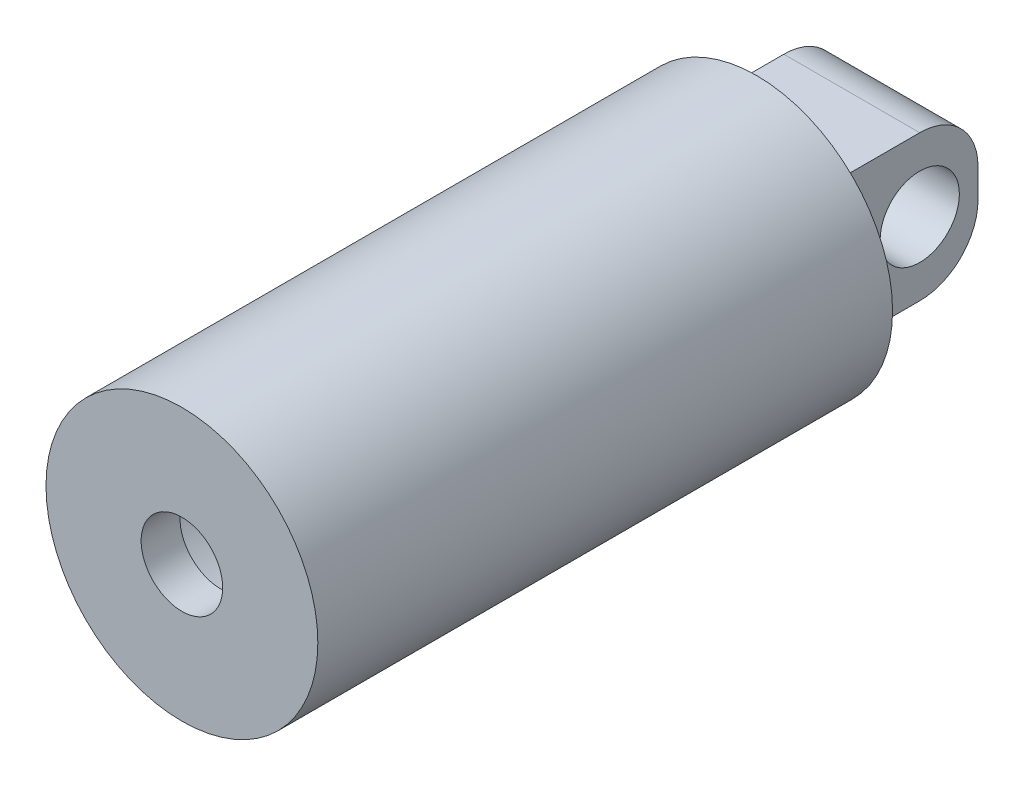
SolidWorks part; units mm, degrees
ref_plane "Front Plane" through (0, 0, 0) normal (0, 0, 1) x (1, 0, 0)
ref_plane "Top Plane" through (0, 0, 0) normal (0, 1, 0) x (1, 0, 0)
ref_plane "Right Plane" through (0, 0, 0) normal (1, 0, 0) x (0, 0, -1)
sketch "Sketch1" plane through (0, 0, 0) normal (0, 0, 1) x (1, 0, 0)
  circle A0 centre (0, 0) radius 38.1
  circle A1 centre (0, 0) radius 44.45
  dimension "D1" = 76.2
  dimension "D2" = 6.35
extrude "Boss-Extrude1" add sketch "Sketch1" against normal blind 190.5
sketch "Sketch2" plane through (0, 0, 0) normal (0, 0, 1) x (1, 0, 0)
  circle A0 centre (0, 0) radius 13.335
  circle A1 centre (0, 0) radius 44.45
  circle A2 centre (0, 0) radius 44.45
  dimension "D2" = 26.67
  dimension "D1" = 0
extrude "Boss-Extrude2" add sketch "Sketch2" against normal blind 12.7
sketch "Sketch3" plane through (0, 0, -190.5) normal (0, 0, -1) x (-1, 0, 0)
  circle A1 centre (0, 0) radius 44.45
  circle A2 centre (0, 0) radius 44.45
  dimension "D1" = 0
extrude "Boss-Extrude3" add sketch "Sketch3" against normal blind 12.7
sketch "Sketch4" plane through (0, 0, -190.5) normal (0, 0, -1) x (-1, 0, 0)
  line L1 (-22.225, 23.8125) -> (22.225, 23.8125)
  line L2 (-22.225, 23.8125) -> (-22.225, -23.8125)
  line L3 (-22.225, -23.8125) -> (22.225, -23.8125)
  line L4 (22.225, 23.8125) -> (22.225, -23.8125)
  line L5 (-22.225, 23.8125) -> (22.225, -23.8125) construction
  line L6 (-22.225, -23.8125) -> (22.225, 23.8125) construction
  point P0 (0, 0)
  dimension "D1" = 44.45
  dimension "D2" = 47.625
extrude "Boss-Extrude4" add sketch "Sketch4" along normal blind 47.625
fillet "Fillet1" radius 19.05 2 edges at (0, -23.8125, -238.125) (0, 23.8125, -238.125)
sketch "Sketch5" plane through (22.225, 0, 0) normal (1, 0, 0) x (0, 0, -1)
  line L0 (190.5, 0) -> (219.075, 0) construction
  line L1 (190.5, 23.8125) -> (190.5, -23.8125) construction
  circle A0 centre (219.075, 0) radius 12.954
  dimension "D1" = 25.908
  dimension "D2" = 28.575
extrude "Cut-Extrude1" cut sketch "Sketch5" against normal blind 54.61
sketch "Sketch6" plane through (0, 0, 0) normal (1, 0, 0) x (0, 0, -1)
  line L0 (0, 0) -> (97.917, 0) construction
  line L1 (97.917, -64.9178) -> (97.917, 64.9178)
  line L2 (72.517, -63.2414) -> (72.517, 63.2414)
  point P6 (97.917, 0)
  point P9 (72.517, 0)
  dimension "D1" = 25.4
  dimension "D2" = 97.917
sketch "Sketch7" plane through (0, 0, -190.5) normal (0, 0, -1) x (-1, 0, 0)
  line L0 (-22.225, -23.8125) -> (22.225, -23.8125) construction
  line L1 (22.225, -23.8125) -> (22.225, 23.8125) construction
  line L2 (22.225, 23.8125) -> (-22.225, 23.8125) construction
  line L3 (-22.225, 23.8125) -> (-22.225, -23.8125) construction
  line L4 (-22.225, -23.8125) -> (22.225, -23.8125)
  line L5 (22.225, -23.8125) -> (22.225, 23.8125)
  line L6 (22.225, 23.8125) -> (-22.225, 23.8125)
  line L7 (-22.225, 23.8125) -> (-22.225, -23.8125)
  circle A1 centre (0, 0) radius 44.45
  circle A2 centre (0, 0) radius 44.45
  dimension "D1" = 0
extrude "Cut-Extrude2" cut sketch "Sketch7" against normal blind 2.54
